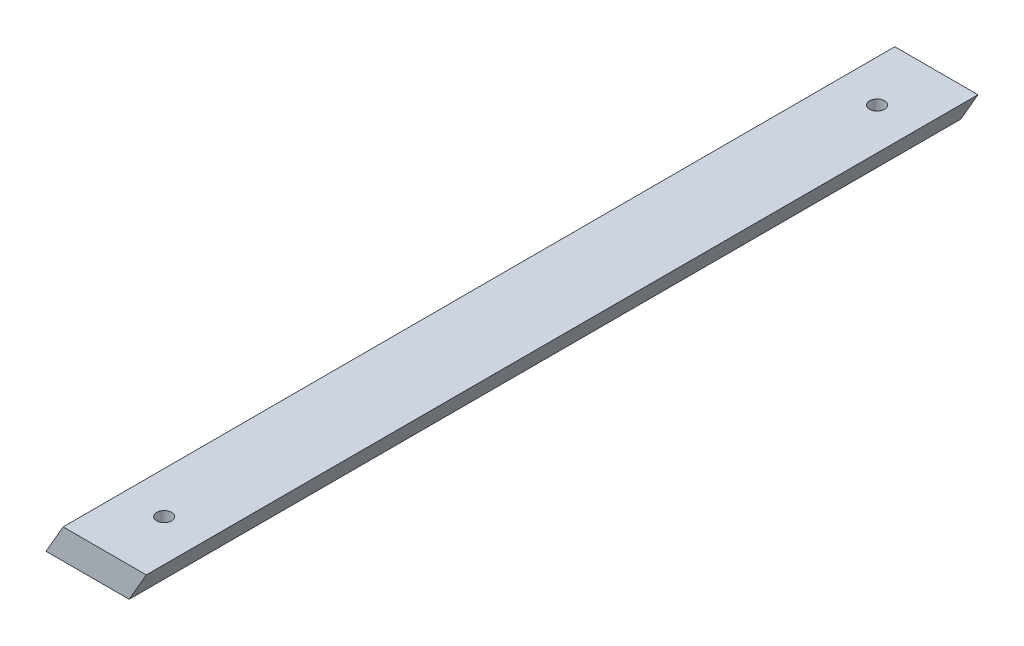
SolidWorks part; units mm, degrees
ref_plane "Front Plane" through (0, 0, 0) normal (0, 0, 1) x (1, 0, 0)
ref_plane "Top Plane" through (0, 0, 0) normal (0, 1, 0) x (1, 0, 0)
ref_plane "Right Plane" through (0, 0, 0) normal (1, 0, 0) x (0, 0, -1)
sketch "Sketch1" plane through (0, 0, 0) normal (0, 0, 1) x (1, 0, 0)
  line L0 (14, 5) -> (8.2265, -5)
  line L1 (14, -5) -> (-14, -5)
  line L2 (14, -5) -> (14, 5)
  line L3 (14, 5) -> (-14, 5)
  line L4 (-14, -5) -> (-14, 5)
  line L5 (14, -5) -> (-14, 5) construction
  line L6 (14, 5) -> (-14, -5) construction
  line L7 (-14, 5) -> (-19.7735, -5)
  line L8 (-19.7735, -5) -> (-14, -5)
  point P0 (0, 0)
  dimension "D1" = 10
  dimension "D2" = 28
  dimension "D3" = 120
extrude "Boss-Extrude1" add sketch "Sketch1" along normal mid plane 280 contours L7 L8 L4 | L4 L1 L0 L3
sketch "Sketch2" plane through (0, 5, 0) normal (0, 1, 0) x (1, 0, 0)
  line L1 (0, -120) -> (0, -140) construction
  line L2 (14, -140) -> (-14, -140) construction
  circle A0 centre (0, -120) radius 2.5
  dimension "D1" = 5
  dimension "D2" = 20
extrude "Cut-Extrude1" cut sketch "Sketch2" against normal through all
mirror "Mirror1" about plane through (0, 0, 0) normal (0, 0, 1) of "Cut-Extrude1"
